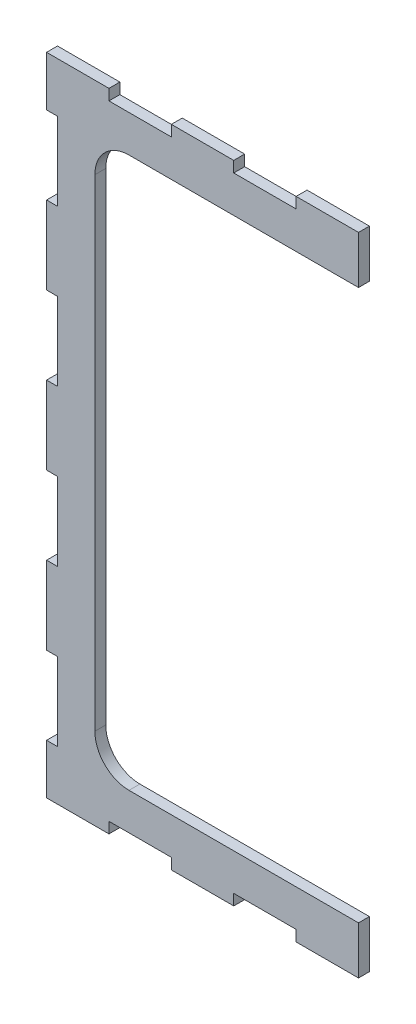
SolidWorks part; units mm, degrees
ref_plane "Front Plane" through (0, 0, 0) normal (0, 0, 1) x (1, 0, 0)
ref_plane "Top Plane" through (0, 0, 0) normal (0, 1, 0) x (1, 0, 0)
ref_plane "Right Plane" through (0, 0, 0) normal (1, 0, 0) x (0, 0, -1)
sketch "Sketch1" plane through (0, 0, 0) normal (0, 0, 1) x (1, 0, 0)
  line L0 (-311.4214, 497.0744) -> (-311.4214, 513.0744)
  line L1 (-494.3014, 497.0744) -> (-402.8614, 497.0744)
  line L2 (-585.7414, -433.3256) -> (-585.7414, -360.1736)
  line L3 (-494.3014, -417.3256) -> (-402.8614, -417.3256)
  line L4 (-128.5414, 513.0744) -> (-128.5414, 443.0744)
  line L5 (-128.5414, -363.3256) -> (-128.5414, -433.3256)
  line L8 (-569.7414, 211.3237) -> (-569.7414, 97.0237)
  line L9 (-585.7414, 513.0744) -> (-494.3014, 513.0744)
  line L10 (-494.3014, 497.0744) -> (-494.3014, 513.0744)
  line L11 (-402.8614, 513.0744) -> (-311.4214, 513.0744)
  line L12 (-402.8614, 497.0744) -> (-402.8614, 513.0744)
  line L13 (-585.7414, 439.9224) -> (-569.7414, 439.9224)
  line L14 (-219.9814, 513.0744) -> (-128.5414, 513.0744)
  line L15 (-219.9814, 497.0744) -> (-219.9814, 513.0744)
  line L16 (-311.4214, 497.0744) -> (-219.9814, 497.0744)
  line L17 (-219.9814, -433.3256) -> (-128.5414, -433.3256)
  line L18 (-219.9814, -417.3256) -> (-219.9814, -433.3256)
  line L19 (-311.4214, -417.3256) -> (-219.9814, -417.3256)
  line L20 (-311.4214, -417.3256) -> (-311.4214, -433.3256)
  line L21 (-402.8614, -433.3256) -> (-311.4214, -433.3256)
  line L22 (-402.8614, -417.3256) -> (-402.8614, -433.3256)
  line L23 (-585.7414, 325.6224) -> (-585.7414, 211.3237)
  line L24 (-494.3014, -417.3256) -> (-494.3014, -433.3256)
  line L25 (-585.7414, -433.3256) -> (-494.3014, -433.3256)
  line L26 (-585.7414, 325.6224) -> (-569.7414, 325.6224)
  line L27 (-569.7414, 439.9224) -> (-569.7414, 325.6224)
  line L28 (-585.7414, 211.3237) -> (-569.7414, 211.3237)
  line L29 (-128.5414, 497.0744) -> (-128.5414, 513.0744)
  line L30 (-585.7414, 97.0237) -> (-569.7414, 97.0237)
  line L31 (-569.7414, -17.275) -> (-569.7414, -131.575)
  line L32 (-585.7414, -17.275) -> (-569.7414, -17.275)
  line L33 (-585.7414, -131.575) -> (-569.7414, -131.575)
  line L34 (-569.7414, -245.8736) -> (-569.7414, -360.1736)
  line L35 (-585.7414, -245.8736) -> (-569.7414, -245.8736)
  line L36 (-585.7414, -360.1736) -> (-569.7414, -360.1736)
  line L37 (-585.7414, 439.9224) -> (-585.7414, 513.0744)
  line L38 (-585.7414, -17.275) -> (-585.7414, 97.0237)
  line L39 (-585.7414, -245.8736) -> (-585.7414, -131.575)
  line L74 (-514.9814, 443.0744) -> (-128.5414, 443.0744)
  line L75 (-514.9814, 443.0744) -> (-514.9814, -363.3256)
  line L76 (-514.9814, -363.3256) -> (-128.5414, -363.3256)
  point P0 (-585.7414, -188.7243)
extrude "Boss-Extrude1" add sketch "Sketch1" along normal blind 16
fillet "Fillet2" radius 50 2 edges at (-514.9814, 443.0744, 8) (-514.9814, -363.3256, 8)
equation "\"length\"= 36in"
equation "\"height\"= 18in"
equation "\"material thickness\"= 16mm"
equation "\"D1@Boss-Extrude1\"=\"material thickness\""
equation "\"D4@Sketch1\"=\"height\"/5"
equation "\"D6@Sketch1\"=\"material thickness\""
equation "\"D7@Sketch1\"=\"length\"/8"
equation "\"D15@Sketch1\"=\"length\""
equation "\"D16@Sketch1\"=\"material thickness\""
